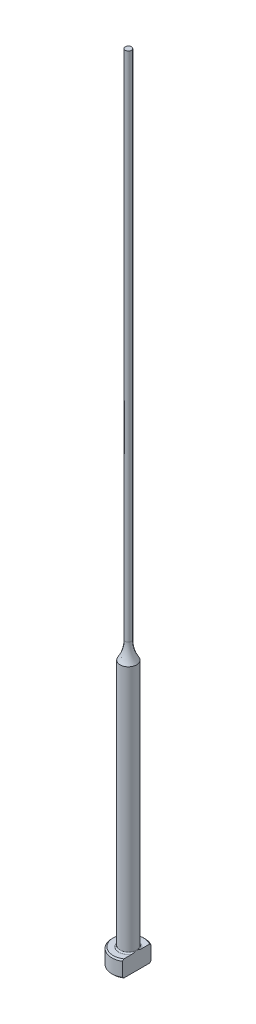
SolidWorks part; units mm, degrees
ref_plane "Front Plane" through (0, 0, 0) normal (0, 0, 1) x (1, 0, 0)
ref_plane "Top Plane" through (0, 0, 0) normal (0, 1, 0) x (1, 0, 0)
ref_plane "Right Plane" through (0, 0, 0) normal (1, 0, 0) x (0, 0, -1)
sketch "Sketch1" plane through (0, 0, 0) normal (0, 0, 1) x (1, 0, 0)
  line L0 (0, 259.9588) -> (0, -15.1925) construction
  line L1 (0, 0) -> (-3.175, 0)
  line L2 (-3.175, 0) -> (-3.175, 3.175)
  line L3 (-3.175, 3.175) -> (-1.5875, 3.175)
  line L4 (-0.5944, 54.2098) -> (-0.5944, 152.4)
  line L5 (-0.5944, 152.4) -> (0, 152.4)
  line L6 (0, 152.4) -> (0, 0)
  line L7 (-1.5875, 3.175) -> (-1.5875, 50.8)
  arc A0 (-1.5875, 50.8) -> (-0.5944, 54.2098) centre (-6.9444, 54.2098) ccw
  point P13 (-1.5875, 0)
  dimension "D1" = 6.35
  dimension "L" = 152.4
  dimension "D2" = 3.175
  dimension "H" = 6.35
  dimension "T" = 3.175
  dimension "D" = 1.1887
  dimension "S" = 50.8
revolve "Revolve1" add sketch "Sketch1" angle 360 about L0
chamfer "Chamfer1" distance 0.254 angle 45 2 edges at (0, 3.175, 3.175) (0, 0, 3.175)
fillet "Fillet1" radius 0.254 1 edges at (0, 3.175, 1.5875)
sketch "Sketch2" plane through (0, 0, 0) normal (0, 1, 0) x (1, 0, 0)
  line L0 (1.5875, -2.7496) -> (1.5875, 2.7496)
  circle A0 centre (0, 0) radius 3.175 construction
  arc A2 (1.5875, -2.7496) -> (1.5875, 2.7496) centre (0, 0) ccw
  circle A3 centre (0, 0) radius 3.175 construction
  circle A4 centre (0, 0) radius 1.5875 construction
extrude "Key Head" cut sketch "Sketch2" along normal up to next
